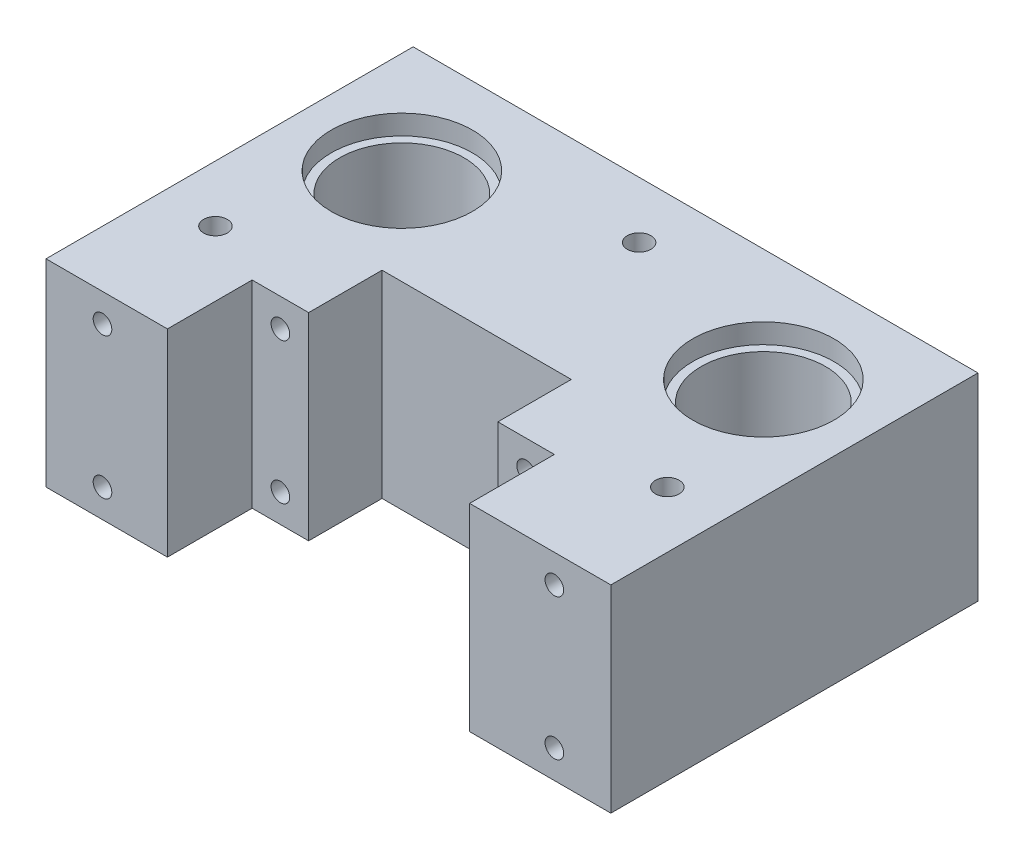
SolidWorks part; units mm, degrees
ref_plane "前视基准面" through (0, 0, 0) normal (0, 0, 1) x (1, 0, 0)
ref_plane "上视基准面" through (0, 0, 0) normal (0, 1, 0) x (1, 0, 0)
ref_plane "右视基准面" through (0, 0, 0) normal (1, 0, 0) x (0, 0, -1)
sketch "草图1" plane through (0, 0, 0) normal (0, 0, 1) x (1, 0, 0)
  line L0 (0, 0) -> (100, 0)
  line L1 (0, 35) -> (100, 35)
  line L2 (0, 0) -> (0, 35)
  line L3 (100, 0) -> (100, 35)
extrude "凸台-拉伸1" add sketch "草图1" along normal blind 65
sketch "草图2" plane through (0, 35, 0) normal (0, 1, 0) x (1, 0, 0)
  line L0 (0, 0) -> (100, 0)
  line L1 (0, -65) -> (21.4975, -65)
  line L2 (0, -65) -> (0, 0)
  line L3 (100, -65) -> (100, 0)
  line L4 (31.4975, -37) -> (64.9975, -37)
  line L5 (21.4975, -50) -> (31.4975, -50)
  line L6 (31.4975, -50) -> (31.4975, -37)
  line L7 (64.9975, -50) -> (64.9975, -37)
  line L8 (74.9975, -65) -> (74.9975, -50)
  line L9 (21.4975, -65) -> (21.4975, -50)
  line L10 (64.9975, -50) -> (74.9975, -50)
  line L11 (74.9975, -65) -> (100, -65)
  circle A0 centre (18, -20) radius 11
  circle A1 centre (82, -20) radius 11
extrude "切除-拉伸1" cut sketch "草图2" against normal blind 65 flip side to cut
sketch "草图3" plane through (0, 35, 0) normal (0, 1, 0) x (1, 0, 0)
  circle A0 centre (18, -20) radius 12.5
  circle A1 centre (82, -20) radius 12.5
extrude "切除-拉伸2" cut sketch "草图3" against normal blind 3.5
sketch "草图4" plane through (0, 35, 0) normal (0, 1, 0) x (1, 0, 0)
  circle A0 centre (50, -10) radius 2.1
  circle A1 centre (10, -45) radius 2.1
  circle A2 centre (90, -45) radius 2.1
extrude "切除-拉伸3" cut sketch "草图4" against normal blind 15
sketch "草图5" plane through (0, 0, 50) normal (0, 0, 1) x (1, 0, 0)
  circle A0 centre (26.4975, 30) radius 1.65
  circle A1 centre (69.9975, 30) radius 1.65
  circle A2 centre (69.9975, 5) radius 1.65
  circle A3 centre (26.4975, 5) radius 1.65
extrude "切除-拉伸4" cut sketch "草图5" against normal blind 15
sketch "草图6" plane through (0, 0, 65) normal (0, 0, 1) x (1, 0, 0)
  circle A0 centre (90, 30) radius 1.65
  circle A1 centre (90, 5) radius 1.65
  circle A2 centre (10, 5) radius 1.65
  circle A3 centre (10, 30) radius 1.65
extrude "切除-拉伸5" cut sketch "草图6" against normal blind 15
sketch "草图7" plane through (0, 35, 0) normal (0, 1, 0) x (1, 0, 0)
  circle A0 centre (36.4975, -32.5) radius 1.65 construction
  circle A1 centre (59.9975, -32.5) radius 1.65 construction
sketch "草图8" plane through (0, 0, 0) normal (0, -1, 0) x (1, 0, 0)
  circle A0 centre (36.4975, 32.5) radius 1.65
  circle A1 centre (59.9975, 32.5) radius 1.65
extrude "切除-拉伸6" cut sketch "草图8" against normal blind 15
